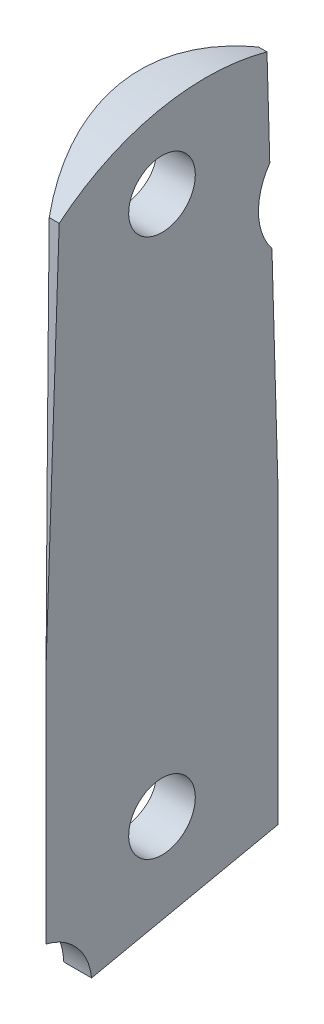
SolidWorks part; units mm, degrees
ref_plane "Front Plane" through (0, 0, 0) normal (0, 0, 1) x (1, 0, 0)
ref_plane "Top Plane" through (0, 0, 0) normal (0, 1, 0) x (1, 0, 0)
ref_plane "Right Plane" through (0, 0, 0) normal (1, 0, 0) x (0, 0, -1)
imported_body "MirrorrightHandle-2-solid1"
sketch "Sketch2" plane through (-6.35, 0, 0) normal (1, 0, 0) x (0, 0, -1)
  line L0 (-180.8706, -48.7161) -> (-181.3137, -33.2457) construction
  line L1 (-181.2757, -34.5714) -> (-181.3137, -33.2457)
  line L2 (-211.314, -39.3564) -> (-213.2702, -95.5219) construction
  line L3 (-211.314, -39.3564) -> (-211.3723, -41.0313)
  arc A1 (-181.3137, -33.2457) -> (-211.314, -39.3564) centre (-190.1331, -66.6449) ccw construction
  arc A2 (-181.6379, -34.4736) -> (-210.5353, -40.3597) centre (-190.1331, -66.6449) ccw
  arc A3 (-181.2757, -34.5714) -> (-211.3723, -41.0313) centre (-190.1331, -66.6449) ccw
  arc A4 (-181.3137, -33.2457) -> (-211.314, -39.3564) centre (-190.1331, -66.6449) ccw
  dimension "D1" = 1.27
extrude "Cut-Extrude1" cut sketch "Sketch2" against normal through all
